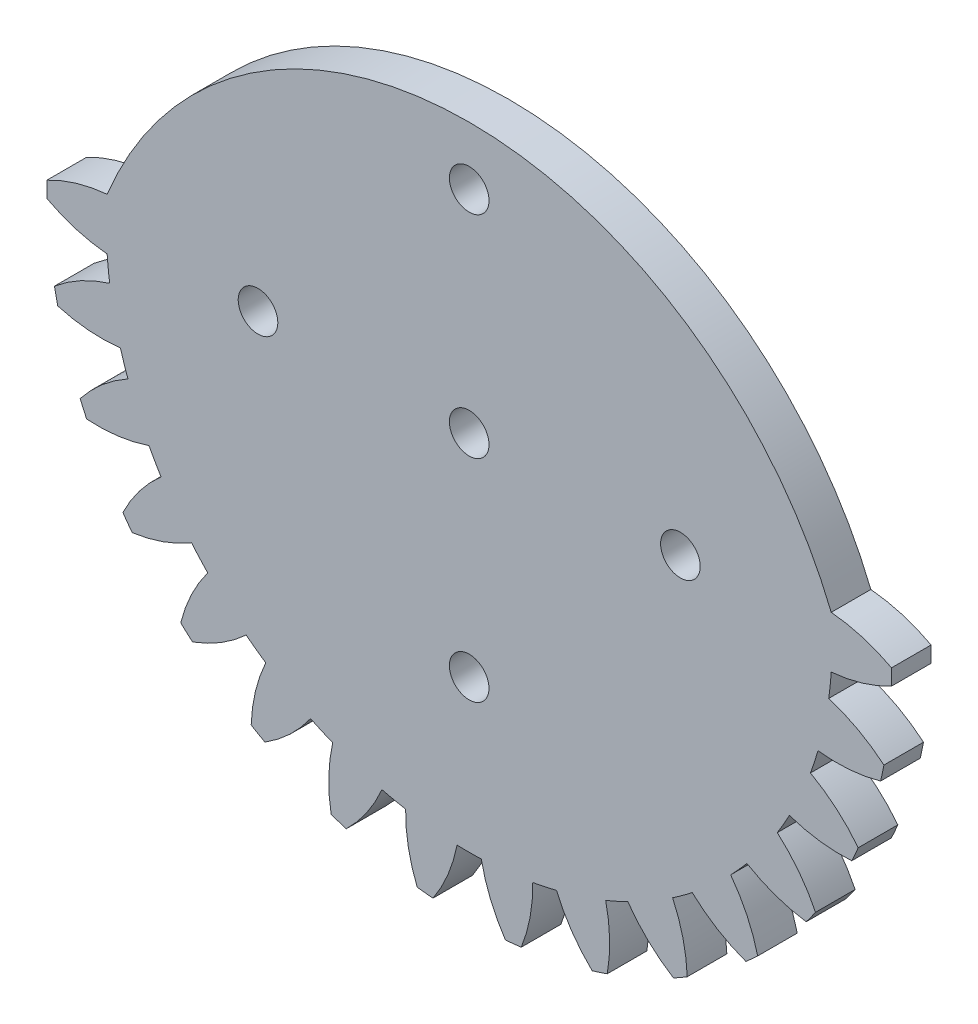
SolidWorks part; units mm, degrees
ref_plane "前视基准面" through (0, 0, 0) normal (0, 0, 1) x (1, 0, 0)
ref_plane "上视基准面" through (0, 0, 0) normal (0, 1, 0) x (1, 0, 0)
ref_plane "右视基准面" through (0, 0, 0) normal (1, 0, 0) x (0, 0, -1)
sketch "草图1" plane through (0, 0, 0) normal (0, 0, 1) x (1, 0, 0)
  arc A0 (-88.7346, 50.606) -> (-84.1694, 49.2488) centre (-83.1005, 61.2011) ccw
  arc A1 (-84.1694, 49.2488) -> (-83.9774, 47.4218) centre (-56.7403, 51.2081) ccw
  arc A2 (-83.9774, 47.4218) -> (-88.1607, 45.1451) centre (-80.4468, 35.9529) ccw
  arc A3 (-88.1607, 45.1451) -> (-87.9103, 43.9672) centre (-56.7403, 51.2081) ccw
  arc A4 (-87.9103, 43.9672) -> (-83.1627, 43.5888) centre (-84.6021, 55.5021) ccw
  arc A5 (-83.1627, 43.5888) -> (-82.595, 41.8416) centre (-56.7403, 51.2081) ccw
  arc A6 (-82.595, 41.8416) -> (-86.2135, 38.7449) centre (-76.757, 31.3574) ccw
  arc A7 (-86.2135, 38.7449) -> (-85.7237, 37.6448) centre (-56.7403, 51.2081) ccw
  arc A8 (-85.7237, 37.6448) -> (-81.0011, 38.2618) centre (-84.8861, 49.6155) ccw
  arc A9 (-81.0011, 38.2618) -> (-80.0826, 36.6708) centre (-56.7403, 51.2081) ccw
  arc A10 (-80.0826, 36.6708) -> (-82.9782, 32.8894) centre (-72.1924, 27.6295) ccw
  arc A11 (-82.9782, 32.8894) -> (-82.2703, 31.9152) centre (-56.7403, 51.2081) ccw
  arc A12 (-82.2703, 31.9152) -> (-77.7793, 33.5006) centre (-83.9399, 43.7985) ccw
  arc A13 (-77.7793, 33.5006) -> (-76.55, 32.1353) centre (-56.7403, 51.2081) ccw
  arc A14 (-76.55, 32.1353) -> (-78.5962, 27.8346) centre (-66.9525, 24.9321) ccw
  arc A15 (-78.5962, 27.8346) -> (-77.7012, 27.0288) centre (-56.7403, 51.2081) ccw
  arc A16 (-77.7012, 27.0288) -> (-73.6379, 29.5133) centre (-81.805, 38.3053) ccw
  arc A17 (-73.6379, 29.5133) -> (-72.1517, 28.4335) centre (-56.7403, 51.2081) ccw
  arc A18 (-72.1517, 28.4335) -> (-73.2589, 23.8013) centre (-61.2662, 23.383) ccw
  arc A19 (-73.2589, 23.8013) -> (-72.216, 23.1992) centre (-56.7403, 51.2081) ccw
  arc A20 (-72.216, 23.1992) -> (-68.758, 26.4742) centre (-78.5746, 33.376) ccw
  arc A21 (-68.758, 26.4742) -> (-67.0798, 25.7269) centre (-56.7403, 51.2081) ccw
  arc A22 (-67.0798, 25.7269) -> (-67.1997, 20.9658) centre (-55.3821, 23.0501) ccw
  arc A23 (-67.1997, 20.9658) -> (-66.0544, 20.5936) centre (-56.7403, 51.2081) ccw
  arc A24 (-66.0544, 20.5936) -> (-63.353, 24.516) centre (-74.3899, 29.2261) ccw
  arc A25 (-63.353, 24.516) -> (-61.556, 24.1341) centre (-56.7403, 51.2081) ccw
  arc A26 (-61.556, 24.1341) -> (-60.6834, 19.452) centre (-49.5574, 23.9478) ccw
  arc A27 (-60.6834, 19.452) -> (-59.4858, 19.3261) centre (-56.7403, 51.2081) ccw
  arc A28 (-59.4858, 19.3261) -> (-57.6588, 23.7245) centre (-69.4339, 26.0369) ccw
  arc A29 (-57.6588, 23.7245) -> (-55.8217, 23.7245) centre (-56.7403, 51.2081) ccw
  arc A30 (-55.8217, 23.7245) -> (-53.9948, 19.3261) centre (-44.0467, 26.0369) ccw
  arc A31 (-53.9948, 19.3261) -> (-52.7972, 19.452) centre (-56.7403, 51.2081) ccw
  arc A32 (-52.7972, 19.452) -> (-51.9246, 24.1341) centre (-63.9232, 23.9478) ccw
  arc A33 (-51.9246, 24.1341) -> (-50.1276, 24.516) centre (-56.7403, 51.2081) ccw
  arc A34 (-50.1276, 24.516) -> (-47.4262, 20.5936) centre (-39.0906, 29.2261) ccw
  arc A35 (-47.4262, 20.5936) -> (-46.2809, 20.9658) centre (-56.7403, 51.2081) ccw
  arc A36 (-46.2809, 20.9658) -> (-46.4008, 25.7269) centre (-58.0985, 23.0501) ccw
  arc A37 (-46.4008, 25.7269) -> (-44.7226, 26.4742) centre (-56.7403, 51.2081) ccw
  arc A38 (-44.7226, 26.4742) -> (-41.2646, 23.1992) centre (-34.906, 33.376) ccw
  arc A39 (-41.2646, 23.1992) -> (-40.2217, 23.8013) centre (-56.7403, 51.2081) ccw
  arc A40 (-40.2217, 23.8013) -> (-41.3289, 28.4335) centre (-52.2144, 23.383) ccw
  arc A41 (-41.3289, 28.4335) -> (-39.8427, 29.5133) centre (-56.7403, 51.2081) ccw
  arc A42 (-39.8427, 29.5133) -> (-35.7794, 27.0288) centre (-31.6756, 38.3053) ccw
  arc A43 (-35.7794, 27.0288) -> (-34.8844, 27.8346) centre (-56.7403, 51.2081) ccw
  arc A44 (-34.8844, 27.8346) -> (-36.9306, 32.1353) centre (-46.5281, 24.9321) ccw
  arc A45 (-36.9306, 32.1353) -> (-35.7013, 33.5006) centre (-56.7403, 51.2081) ccw
  arc A46 (-35.7013, 33.5006) -> (-31.2103, 31.9152) centre (-29.5407, 43.7985) ccw
  arc A47 (-31.2103, 31.9152) -> (-30.5024, 32.8894) centre (-56.7403, 51.2081) ccw
  arc A48 (-30.5024, 32.8894) -> (-33.398, 36.6708) centre (-41.2882, 27.6295) ccw
  arc A49 (-33.398, 36.6708) -> (-32.4795, 38.2618) centre (-56.7403, 51.2081) ccw
  arc A50 (-32.4795, 38.2618) -> (-27.7569, 37.6448) centre (-28.5945, 49.6155) ccw
  arc A51 (-27.7569, 37.6448) -> (-27.2671, 38.7449) centre (-56.7403, 51.2081) ccw
  arc A52 (-27.2671, 38.7449) -> (-30.8856, 41.8416) centre (-36.7236, 31.3574) ccw
  arc A53 (-30.8856, 41.8416) -> (-30.3179, 43.5888) centre (-56.7403, 51.2081) ccw
  arc A54 (-30.3179, 43.5888) -> (-25.5703, 43.9672) centre (-28.8785, 55.5021) ccw
  arc A55 (-25.5703, 43.9672) -> (-25.3199, 45.1451) centre (-56.7403, 51.2081) ccw
  arc A56 (-25.3199, 45.1451) -> (-29.5032, 47.4218) centre (-33.0338, 35.9529) ccw
  arc A57 (-29.5032, 47.4218) -> (-29.3112, 49.2488) centre (-56.7403, 51.2081) ccw
  arc A58 (-29.3112, 49.2488) -> (-24.746, 50.606) centre (-30.3801, 61.2011) ccw
  arc A59 (-24.746, 50.606) -> (-24.746, 51.8102) centre (-56.7403, 51.2081) ccw
  arc A60 (-24.746, 51.8102) -> (-29.3112, 53.1674) centre (-30.3801, 41.2151) ccw
  arc A61 (-29.3112, 53.1674) -> (-29.5032, 54.9945) centre (-56.7403, 51.2081) ccw
  arc A62 (-29.5032, 54.9945) -> (-25.3199, 57.2711) centre (-33.0338, 66.4633) ccw
  arc A63 (-25.3199, 57.2711) -> (-25.5703, 58.4491) centre (-56.7403, 51.2081) ccw
  arc A64 (-25.5703, 58.4491) -> (-30.3179, 58.8274) centre (-28.8785, 46.9141) ccw
  arc A65 (-30.3179, 58.8274) -> (-30.8856, 60.5746) centre (-56.7403, 51.2081) ccw
  arc A66 (-30.8856, 60.5746) -> (-27.2671, 63.6713) centre (-36.7236, 71.0588) ccw
  arc A67 (-27.2671, 63.6713) -> (-27.7569, 64.7715) centre (-56.7403, 51.2081) ccw
  arc A68 (-27.7569, 64.7715) -> (-32.4795, 64.1545) centre (-28.5945, 52.8007) ccw
  arc A69 (-32.4795, 64.1545) -> (-33.398, 65.7454) centre (-56.7403, 51.2081) ccw
  arc A70 (-33.398, 65.7454) -> (-30.5024, 69.5268) centre (-41.2882, 74.7868) ccw
  arc A71 (-30.5024, 69.5268) -> (-31.2103, 70.501) centre (-56.7403, 51.2081) ccw
  arc A72 (-31.2103, 70.501) -> (-35.7013, 68.9157) centre (-29.5407, 58.6178) ccw
  arc A73 (-35.7013, 68.9157) -> (-36.9306, 70.2809) centre (-56.7403, 51.2081) ccw
  arc A74 (-36.9306, 70.2809) -> (-34.8844, 74.5816) centre (-46.5281, 77.4842) ccw
  arc A75 (-34.8844, 74.5816) -> (-35.7794, 75.3874) centre (-56.7403, 51.2081) ccw
  arc A76 (-35.7794, 75.3874) -> (-39.8427, 72.903) centre (-31.6756, 64.1109) ccw
  arc A77 (-39.8427, 72.903) -> (-41.3289, 73.9828) centre (-56.7403, 51.2081) ccw
  arc A78 (-41.3289, 73.9828) -> (-40.2217, 78.615) centre (-52.2144, 79.0332) ccw
  arc A79 (-40.2217, 78.615) -> (-41.2646, 79.2171) centre (-56.7403, 51.2081) ccw
  arc A80 (-41.2646, 79.2171) -> (-44.7226, 75.9421) centre (-34.906, 69.0402) ccw
  arc A81 (-44.7226, 75.9421) -> (-46.4008, 76.6893) centre (-56.7403, 51.2081) ccw
  arc A82 (-46.4008, 76.6893) -> (-46.2809, 81.4505) centre (-58.0985, 79.3662) ccw
  arc A83 (-46.2809, 81.4505) -> (-47.4262, 81.8226) centre (-56.7403, 51.2081) ccw
  arc A84 (-47.4262, 81.8226) -> (-50.1276, 77.9002) centre (-39.0906, 73.1902) ccw
  arc A85 (-50.1276, 77.9002) -> (-51.9246, 78.2822) centre (-56.7403, 51.2081) ccw
  arc A86 (-51.9246, 78.2822) -> (-52.7972, 82.9642) centre (-63.9232, 78.4685) ccw
  arc A87 (-52.7972, 82.9642) -> (-53.9948, 83.0901) centre (-56.7403, 51.2081) ccw
  arc A88 (-53.9948, 83.0901) -> (-55.8217, 78.6918) centre (-44.0467, 76.3794) ccw
  arc A89 (-55.8217, 78.6918) -> (-57.6588, 78.6918) centre (-56.7403, 51.2081) ccw
  arc A90 (-57.6588, 78.6918) -> (-59.4858, 83.0901) centre (-69.4339, 76.3794) ccw
  arc A91 (-59.4858, 83.0901) -> (-60.6834, 82.9642) centre (-56.7403, 51.2081) ccw
  arc A92 (-60.6834, 82.9642) -> (-61.556, 78.2822) centre (-49.5574, 78.4685) ccw
  arc A93 (-61.556, 78.2822) -> (-63.353, 77.9002) centre (-56.7403, 51.2081) ccw
  arc A94 (-63.353, 77.9002) -> (-66.0544, 81.8226) centre (-74.3899, 73.1902) ccw
  arc A95 (-66.0544, 81.8226) -> (-67.1997, 81.4505) centre (-56.7403, 51.2081) ccw
  arc A96 (-67.1997, 81.4505) -> (-67.0798, 76.6893) centre (-55.3821, 79.3662) ccw
  arc A97 (-67.0798, 76.6893) -> (-68.758, 75.9421) centre (-56.7403, 51.2081) ccw
  arc A98 (-68.758, 75.9421) -> (-72.216, 79.2171) centre (-78.5746, 69.0402) ccw
  arc A99 (-72.216, 79.2171) -> (-73.2589, 78.615) centre (-56.7403, 51.2081) ccw
  arc A100 (-73.2589, 78.615) -> (-72.1517, 73.9828) centre (-61.2662, 79.0332) ccw
  arc A101 (-72.1517, 73.9828) -> (-73.6379, 72.903) centre (-56.7403, 51.2081) ccw
  arc A102 (-73.6379, 72.903) -> (-77.7012, 75.3874) centre (-81.805, 64.1109) ccw
  arc A103 (-77.7012, 75.3874) -> (-78.5962, 74.5816) centre (-56.7403, 51.2081) ccw
  arc A104 (-78.5962, 74.5816) -> (-76.55, 70.2809) centre (-66.9525, 77.4842) ccw
  arc A105 (-76.55, 70.2809) -> (-77.7793, 68.9157) centre (-56.7403, 51.2081) ccw
  arc A106 (-77.7793, 68.9157) -> (-82.2703, 70.501) centre (-83.9399, 58.6178) ccw
  arc A107 (-82.2703, 70.501) -> (-82.9782, 69.5268) centre (-56.7403, 51.2081) ccw
  arc A108 (-82.9782, 69.5268) -> (-80.0826, 65.7454) centre (-72.1924, 74.7868) ccw
  arc A109 (-80.0826, 65.7454) -> (-81.0011, 64.1545) centre (-56.7403, 51.2081) ccw
  arc A110 (-81.0011, 64.1545) -> (-85.7237, 64.7715) centre (-84.8861, 52.8007) ccw
  arc A111 (-85.7237, 64.7715) -> (-86.2135, 63.6713) centre (-56.7403, 51.2081) ccw
  arc A112 (-86.2135, 63.6713) -> (-82.595, 60.5746) centre (-76.757, 71.0588) ccw
  arc A113 (-82.595, 60.5746) -> (-83.1627, 58.8274) centre (-56.7403, 51.2081) ccw
  arc A114 (-83.1627, 58.8274) -> (-87.9103, 58.4491) centre (-84.6021, 46.9141) ccw
  arc A115 (-87.9103, 58.4491) -> (-88.1607, 57.2711) centre (-56.7403, 51.2081) ccw
  arc A116 (-88.1607, 57.2711) -> (-83.9774, 54.9945) centre (-80.4468, 66.4633) ccw
  arc A117 (-83.9774, 54.9945) -> (-84.1694, 53.1674) centre (-56.7403, 51.2081) ccw
  arc A118 (-84.1694, 53.1674) -> (-88.7346, 51.8102) centre (-83.1005, 41.2151) ccw
  arc A119 (-88.7346, 51.8102) -> (-88.7346, 50.606) centre (-56.7403, 51.2081) ccw
extrude "凸台-拉伸1" add sketch "草图1" along normal blind 3
sketch "草图2" plane through (0, 0, 3) normal (0, 0, 1) x (1, 0, 0)
  circle A0 centre (-56.7403, 51.2081) radius 16 construction
  circle A1 centre (-56.7403, 67.2081) radius 1.5
  circle A2 centre (-40.7403, 51.2081) radius 1.5
  circle A3 centre (-56.7403, 35.2081) radius 1.5
  circle A4 centre (-72.7403, 51.2081) radius 1.5
  point P14 (-56.7403, 51.2081)
  dimension "D1" = 4
extrude "切除-拉伸1" cut sketch "草图2" against normal blind 10
sketch "草图3" plane through (0, 0, 3) normal (0, 0, 1) x (1, 0, 0)
  circle A0 centre (-56.7403, 51.2081) radius 1.5
extrude "切除-拉伸2" cut sketch "草图3" against normal blind 10
sketch "草图4" plane through (0, 0, 3) normal (0, 0, 1) x (1, 0, 0)
  line L0 (-84.1694, 53.1674) -> (-102.4271, 70.5128)
  line L1 (-102.4271, 70.5128) -> (-65.9897, 86.3023)
  line L2 (-65.9897, 86.3023) -> (-22.2648, 82.5371)
  line L3 (-22.2648, 82.5371) -> (-9.1473, 61.8401)
  line L4 (-9.1473, 61.8401) -> (-9.1473, 58.4885)
  line L5 (-29.3112, 53.1674) -> (-9.1473, 58.4885)
  arc A0 (-84.1694, 53.1674) -> (-29.3112, 53.1674) centre (-56.7403, 42) cw
extrude "切除-拉伸3" cut sketch "草图4" against normal blind 10
